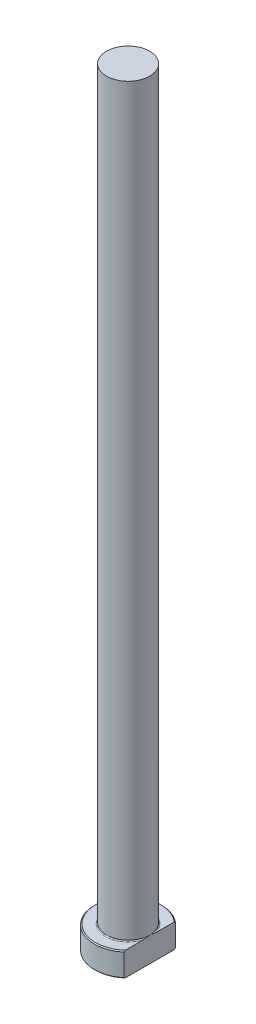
SolidWorks part; units mm, degrees
ref_plane "Front Plane" through (0, 0, 0) normal (0, 0, 1) x (1, 0, 0)
ref_plane "Top Plane" through (0, 0, 0) normal (0, 1, 0) x (1, 0, 0)
ref_plane "Right Plane" through (0, 0, 0) normal (1, 0, 0) x (0, 0, -1)
sketch "Sketch1" plane through (0, 0, 0) normal (0, 0, 1) x (1, 0, 0)
  line L0 (0, 259.9588) -> (0, -15.1925) construction
  line L1 (0, 0) -> (-7, 0)
  line L2 (-7, 0) -> (-7, 5)
  line L3 (-7, 5) -> (-4.5, 5)
  line L4 (-4.5, 5) -> (-4.5, 160)
  line L5 (-4.5, 160) -> (0, 160)
  line L6 (0, 160) -> (0, 0)
  dimension "L" = 160
  dimension "H" = 14
  dimension "T" = 5
  dimension "D" = 9
revolve "Revolve1" add sketch "Sketch1" angle 360 about L0
chamfer "Chamfer1" distance 0.2 angle 45 2 edges at (0, 5, 7) (0, 0, 7)
fillet "Fillet1" radius 0.2 1 edges at (0, 5, 4.5)
sketch "Sketch2" plane through (0, 0, 0) normal (0, 1, 0) x (1, 0, 0)
  line L0 (4.5, 5.3619) -> (4.5, -5.3619)
  circle A0 centre (0, 0) radius 7 construction
  arc A1 (4.5, -5.3619) -> (4.5, 5.3619) centre (0, 0) ccw
  circle A2 centre (0, 0) radius 4.5 construction
extrude "KEY" cut sketch "Sketch2" along normal through all
